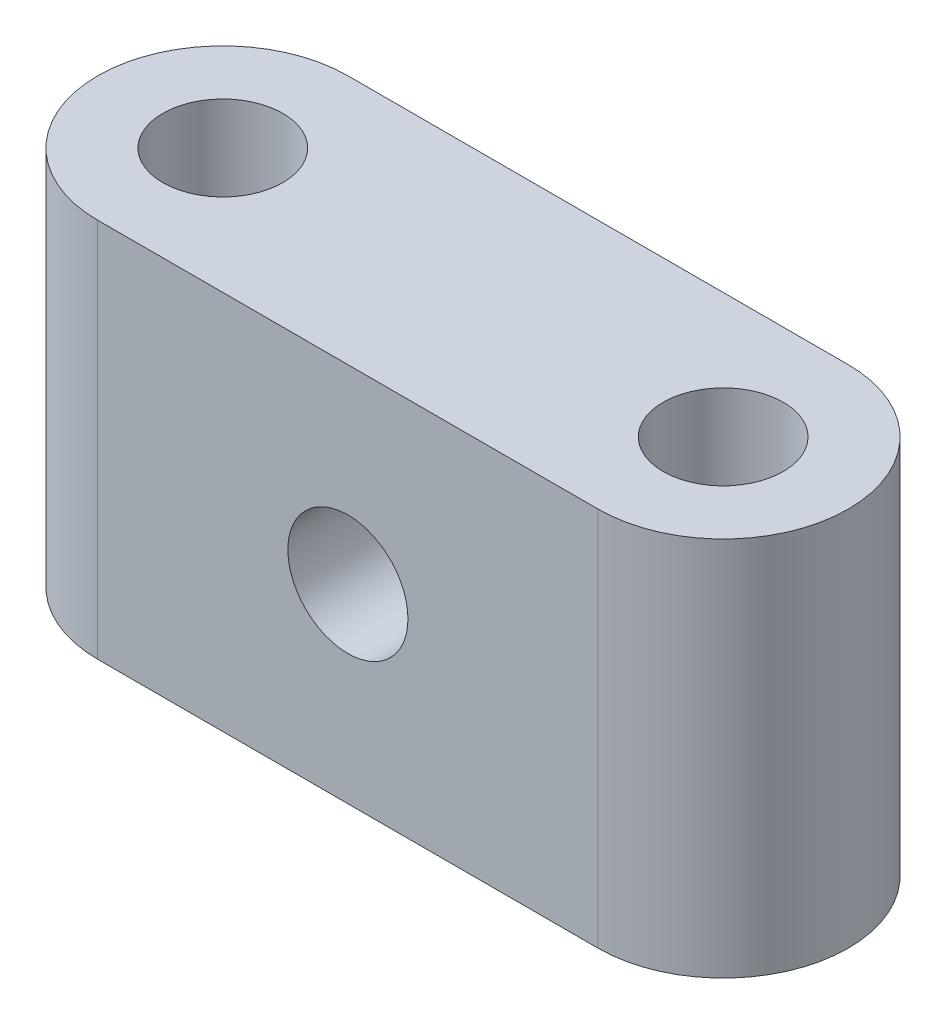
SolidWorks part; units mm, degrees
ref_plane "Front Plane" through (0, 0, 0) normal (0, 0, 1) x (1, 0, 0)
ref_plane "Top Plane" through (0, 0, 0) normal (0, 1, 0) x (1, 0, 0)
ref_plane "Right Plane" through (0, 0, 0) normal (1, 0, 0) x (0, 0, -1)
sketch "Sketch1" plane through (0, 0, 0) normal (0, 1, 0) x (1, 0, 0)
  line L0 (0, 0) -> (50, 0) construction
  line L1 (0, 12.5) -> (50, 12.5)
  line L2 (0, -12.5) -> (50, -12.5)
  arc A0 (0, 12.5) -> (0, -12.5) centre (0, 0) ccw
  arc A1 (50, -12.5) -> (50, 12.5) centre (50, 0) ccw
  circle A2 centre (0, 0) radius 6
  circle A3 centre (50, 0) radius 6
  point P3 (25, 0)
  dimension "D2" = 12.5
  dimension "D3" = 12
  dimension "D4" = 12
  dimension "D1" = 50
extrude "Boss-Extrude1" add sketch "Sketch1" along normal blind 38
sketch "Sketch2" plane through (0, 0, 12.5) normal (0, 0, 1) x (1, 0, 0)
  line L0 (25, 38) -> (25, 0) construction
  line L1 (0, 38) -> (50, 38) construction
  line L2 (0, 0) -> (50, 0) construction
  circle A0 centre (25, 19) radius 6
  dimension "D1" = 12
extrude "Cut-Extrude1" cut sketch "Sketch2" against normal blind 12.5
